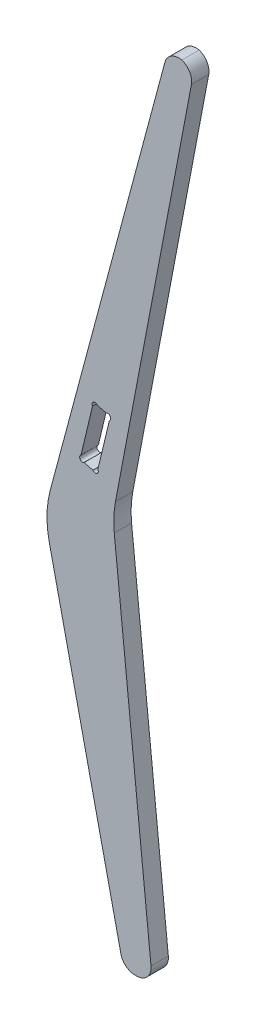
SolidWorks part; units mm, degrees
ref_plane "Plan de face" through (0, 0, 0) normal (0, 0, 1) x (1, 0, 0)
ref_plane "Plan de dessus" through (0, 0, 0) normal (0, 1, 0) x (1, 0, 0)
ref_plane "Plan de droite" through (0, 0, 0) normal (1, 0, 0) x (0, 0, -1)
sketch "Esquisse1" plane through (0, 0, 0) normal (0, 0, 1) x (1, 0, 0)
  line L9 (189.331, 95.7653) -> (141.3697, -83.2289)
  line L11 (223.7362, -371.9909) -> (221.9081, -371.9909)
  line L16 (216.5293, -87.0369) -> (243.6209, -349.9519)
  line L17 (144.4752, -97.1274) -> (202.3992, -356.3601)
  line L18 (192.6555, 42.157) -> (210.1605, 37.9647)
  line L25 (225.8691, 18.5037) -> (247.7304, 133.4003)
  line L28 (169.5591, 21.9753) -> (189.331, 95.7653)
  line L36 (247.7304, 133.4003) -> (212.7557, -50.416)
  line L37 (177.306, 81.1389) -> (234.7501, 65.1798) construction
  line L38 (217.9111, 108.9699) -> (168.2375, -98.4426) construction
  line L39 (192.6555, 42.157) -> (194.7185, 41.663)
  line L40 (178.6812, -16.1929) -> (196.1861, -20.3852)
  line L41 (192.6555, 42.157) -> (178.6812, -16.1929)
  line L42 (210.1605, 37.9647) -> (196.1861, -20.3852)
  line L43 (194.2244, 39.6) -> (192.1614, 40.0941) construction
  line L44 (192.1614, 40.0941) -> (194.2244, 39.6) construction
  line L45 (194.2244, 39.6) -> (194.7185, 41.663) construction
  line L46 (196.7815, 41.1689) -> (210.1605, 37.9647)
  line L47 (194.7185, 41.663) -> (196.7815, 41.1689)
  line L53 (184.6879, 78.4367) -> (234.7216, 65.0302) construction
  line L54 (227.0984, 106.3511) -> (177.4248, -101.0615) construction
  line L55 (192.6555, 42.157) -> (194.7185, 41.663)
  line L56 (178.6812, -16.1929) -> (196.1861, -20.3852)
  line L57 (192.6555, 42.157) -> (178.6812, -16.1929)
  line L58 (210.1605, 37.9647) -> (196.1861, -20.3852)
  line L59 (194.2244, 39.6) -> (192.1614, 40.0941) construction
  line L60 (192.1614, 40.0941) -> (194.2244, 39.6) construction
  line L61 (194.2244, 39.6) -> (194.7185, 41.663) construction
  line L62 (196.7815, 41.1689) -> (210.1605, 37.9647)
  line L63 (194.7185, 41.663) -> (196.7815, 41.1689)
  line L66 (202.3992, -356.3601) -> (141.3697, -83.2289)
  line L67 (243.6209, -349.9519) -> (212.7557, -50.416)
  line L68 (141.3697, -83.2289) -> (270.7792, 399.734)
  line L69 (212.7557, -50.416) -> (297.0654, 392.6906)
  line L70 (270.7792, 399.734) -> (297.0654, 392.6906)
  arc A9 (243.6209, -349.9519) -> (223.7362, -371.9909) centre (223.7362, -352.0009) cw
  arc A10 (221.9081, -371.9909) -> (202.3992, -356.3601) centre (221.9081, -352.0009) cw
  point P6 (245.8918, -371.9909)
  point P9 (205.8918, -371.9909)
  point P14 (201.408, 40.0609)
  point P52 (210.6108, 37.5068)
  point P71 (201.408, 40.0609)
  dimension "D3" = 19.99
  dimension "D9" = 18
  dimension "D14" = 18
  dimension "D4" = 500
  dimension "D2" = 40
  dimension "D8" = 60
  dimension "D13" = 60
extrude "Boss.-Extru.2" add sketch "Esquisse1" along normal blind 18
fillet "Congé1" radius 100 2 edges at (141.3697, -83.2289, 9) (212.7557, -50.416, 9)
fillet "Congé2" radius 15 2 edges at (297.0654, 392.6906, 9) (270.7792, 399.734, 9)
sketch "Esquisse2" plane through (0, 0, 18) normal (0, 0, 1) x (1, 0, 0)
  line L1 (223.7979, -452.1276) -> (202.3992, -356.3601)
  line L2 (254.1494, -452.1276) -> (223.7979, -452.1276)
  line L3 (202.3992, -356.3601) -> (243.6209, -349.9519)
  line L7 (243.6209, -349.9519) -> (254.1494, -452.1276)
extrude "Boss.-Extru.3" add sketch "Esquisse2" against normal blind 18
fillet "Congé3" radius 15 2 edges at (254.1494, -452.1276, 9) (223.7979, -452.1276, 9)
sketch "Esquisse3" plane through (0, 0, 18) normal (0, 0, 1) x (1, 0, 0)
  line L0 (201.408, 40.0609) -> (187.4336, -18.2891) construction
  line L1 (192.6555, 42.157) -> (210.1605, 37.9647) construction
  line L2 (178.6812, -16.1929) -> (196.1861, -20.3852) construction
  line L3 (185.6683, 12.9821) -> (203.1733, 8.7898) construction
  line L4 (192.6555, 42.157) -> (178.6812, -16.1929) construction
  line L5 (210.1605, 37.9647) -> (196.1861, -20.3852) construction
  line L6 (194.2244, 39.6) -> (192.1614, 40.0941) construction
  line L7 (194.2244, 39.6) -> (194.7185, 41.663) construction
  circle A0 centre (194.2244, 39.6) radius 3
  circle A1 centre (194.6172, -17.8282) radius 3
  circle A2 centre (207.6034, 36.3958) radius 3
  circle A3 centre (181.2382, -14.624) radius 3
  point P12 (194.4208, 10.8859)
  point P22 (194.4208, 10.8859)
  dimension "D1" = 6
  dimension "D2" = 2
extrude "Enlèv. mat.-Extru.1" cut sketch "Esquisse3" against normal through all
